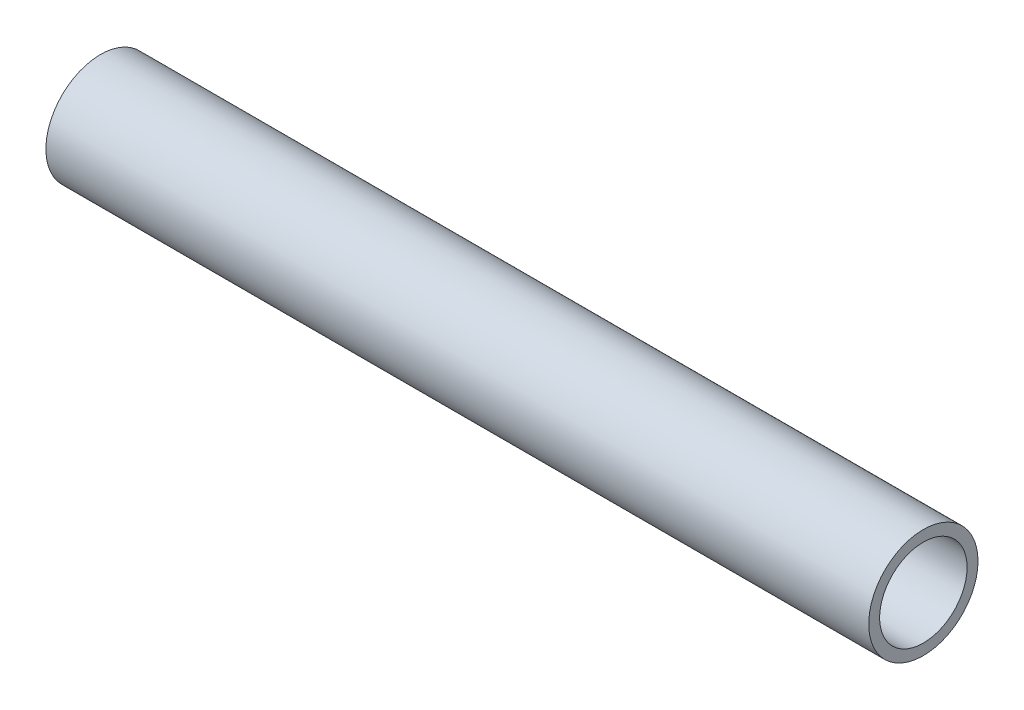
SolidWorks part; units mm, degrees
ref_plane "Front Plane" through (0, 0, 0) normal (0, 0, 1) x (1, 0, 0)
ref_plane "Top Plane" through (0, 0, 0) normal (0, 1, 0) x (1, 0, 0)
ref_plane "Right Plane" through (0, 0, 0) normal (1, 0, 0) x (0, 0, -1)
sketch "Sketch1" plane through (0, 0, 0) normal (1, 0, 0) x (0, 0, -1)
  circle A0 centre (0, 0) radius 15.875
  circle A1 centre (0, 0) radius 12.7
  dimension "D1" = 31.75
  dimension "D2" = 25.4
extrude "Boss-Extrude1" add sketch "Sketch1" along normal mid plane 239.014
